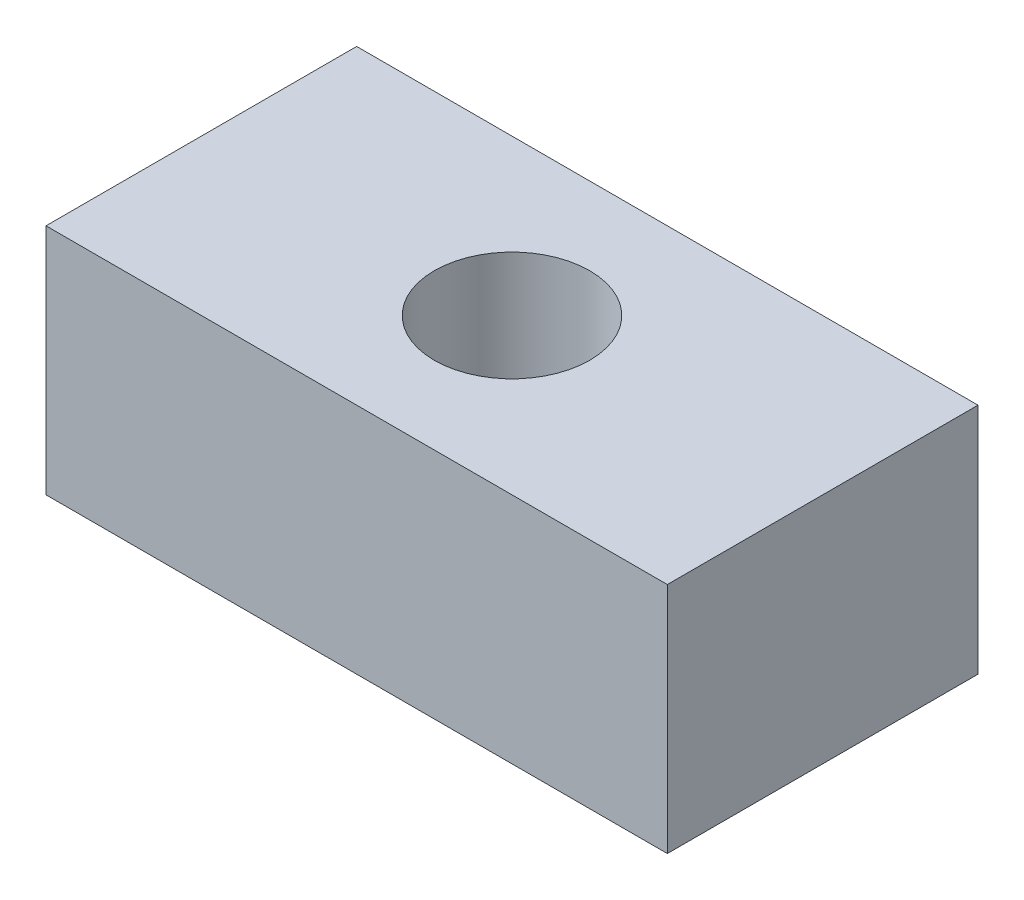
SolidWorks part; units mm, degrees
ref_plane "Front Plane" through (0, 0, 0) normal (0, 0, 1) x (1, 0, 0)
ref_plane "Top Plane" through (0, 0, 0) normal (0, 1, 0) x (1, 0, 0)
ref_plane "Right Plane" through (0, 0, 0) normal (1, 0, 0) x (0, 0, -1)
sketch "Sketch1" plane through (0, 0, 0) normal (0, 1, 0) x (1, 0, 0)
  line L1 (-25.4, -12.7) -> (25.4, -12.7)
  line L2 (-25.4, -12.7) -> (-25.4, 12.7)
  line L3 (-25.4, 12.7) -> (25.4, 12.7)
  line L4 (25.4, -12.7) -> (25.4, 12.7)
  line L5 (-25.4, -12.7) -> (25.4, 12.7) construction
  line L6 (-25.4, 12.7) -> (25.4, -12.7) construction
  point P0 (0, 0)
  dimension "D1" = 25.4
  dimension "D2" = 50.8
extrude "Extrude1" add sketch "Sketch1" along normal blind 19.05
sketch "Sketch2" plane through (0, 19.05, 0) normal (0, 1, 0) x (1, 0, 0)
  circle A0 centre (0, 0) radius 6.35
  dimension "D1" = 12.7
extrude "Extrude2" cut sketch "Sketch2" against normal blind 12.7
